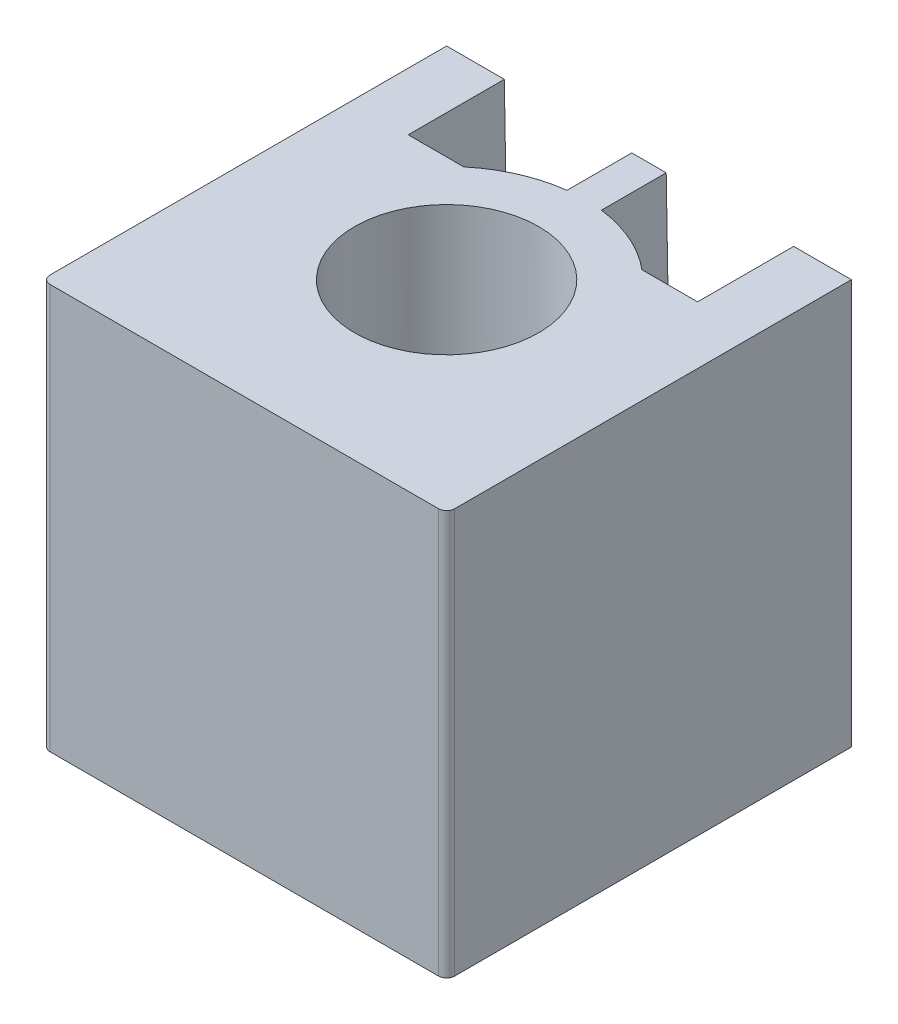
SolidWorks part; units mm, degrees
ref_plane "Plan de face" through (0, 0, 0) normal (0, 0, 1) x (1, 0, 0)
ref_plane "Plan de dessus" through (0, 0, 0) normal (0, 1, 0) x (1, 0, 0)
ref_plane "Plan de droite" through (0, 0, 0) normal (1, 0, 0) x (0, 0, -1)
sketch "Esquisse1" plane through (0, 0, 0) normal (0, 1, 0) x (1, 0, 0)
  line L0 (0, -20.2628) -> (0, 58.4186) construction
  line L1 (-24.3225, 0) -> (29.7425, 0) construction
  line L2 (25, -20.2628) -> (25, 58.4186) construction
  line L3 (-24.3225, 50) -> (34.6841, 50) construction
  line L4 (4, 55.6667) -> (4, -3.7395) construction
  line L6 (-17.7609, 25) -> (29.7425, 25) construction
  line L7 (12.5, 55.6667) -> (12.5, -13.5587) construction
  line L8 (0.5, 0) -> (24.5, 0)
  line L9 (21, 55.6667) -> (21, -3.7395) construction
  line L10 (-3.5126, 1) -> (27.2256, 1) construction
  line L13 (0, 25) -> (25, 25)
  line L15 (25, 25) -> (25, 0.5)
  line L16 (0, 25) -> (0, 0.5)
  arc A2 (24.5, 0) -> (25, 0.5) centre (24.5, 0.5) ccw
  arc A3 (0, 0.5) -> (0.5, 0) centre (0.5, 0.5) ccw
  dimension "D1" = 25
  dimension "D2" = 50
  dimension "D3" = 25
  dimension "D4" = 12.5
  dimension "D5" = 4
extrude "Extrusion1" add sketch "Esquisse1" along normal blind 25
sketch "Esquisse2" plane through (0, 0, 0) normal (0, -1, 0) x (1, 0, 0)
  line L0 (0, 9.4676) -> (0, -60.8727) construction
  line L1 (-5.7031, 0) -> (29.0572, 0) construction
  line L2 (29.0572, -25) -> (-5.7031, -25) construction
  line L3 (12.5, 9.4676) -> (12.5, -60.8727) construction
  line L4 (4, 9.4676) -> (4, -52.8814) construction
  line L5 (9.6643, -12.5) -> (19.7875, -12.5) construction
  line L6 (-5.7031, -5) -> (39.022, -5) construction
  line L7 (-5.7031, -16) -> (39.022, -16) construction
  line L8 (-5.7031, -19.5) -> (39.022, -19.5) construction
  line L9 (11, -52.8814) -> (11, 9.4676) construction
  line L10 (-5.7031, -45) -> (39.022, -45) construction
  line L11 (-5.7031, -34) -> (39.022, -34) construction
  line L12 (-5.7031, -30.5) -> (39.022, -30.5) construction
  line L17 (4, -30.5) -> (11, -30.5)
  line L18 (4, -30.5) -> (4, -19.5)
  line L19 (4, -19.5) -> (6.8431, -19.5)
  line L20 (11, -21.3741) -> (11, -30.5)
  line L21 (21, -19.5) -> (18.1569, -19.5)
  line L22 (14, -21.3741) -> (14, -30.5)
  line L23 (21, -30.5) -> (14, -30.5)
  line L24 (21, -30.5) -> (21, -19.5)
  circle A0 centre (12.5, -12.5) radius 5.25
  arc A1 (14, -21.3741) -> (18.1569, -19.5) centre (12.5, -12.5) ccw
  arc A3 (6.8431, -19.5) -> (11, -21.3741) centre (12.5, -12.5) ccw
  dimension "D1" = 25
  dimension "D2" = 12.5
  dimension "D3" = 1.5
  dimension "D4" = 5
  dimension "D5" = 11
  dimension "D6" = 3.5
  dimension "D7" = 4
  dimension "D8" = 12.5
extrude "Enlèv. mat.-Extru.1" cut sketch "Esquisse2" against normal blind 25 draft 1
